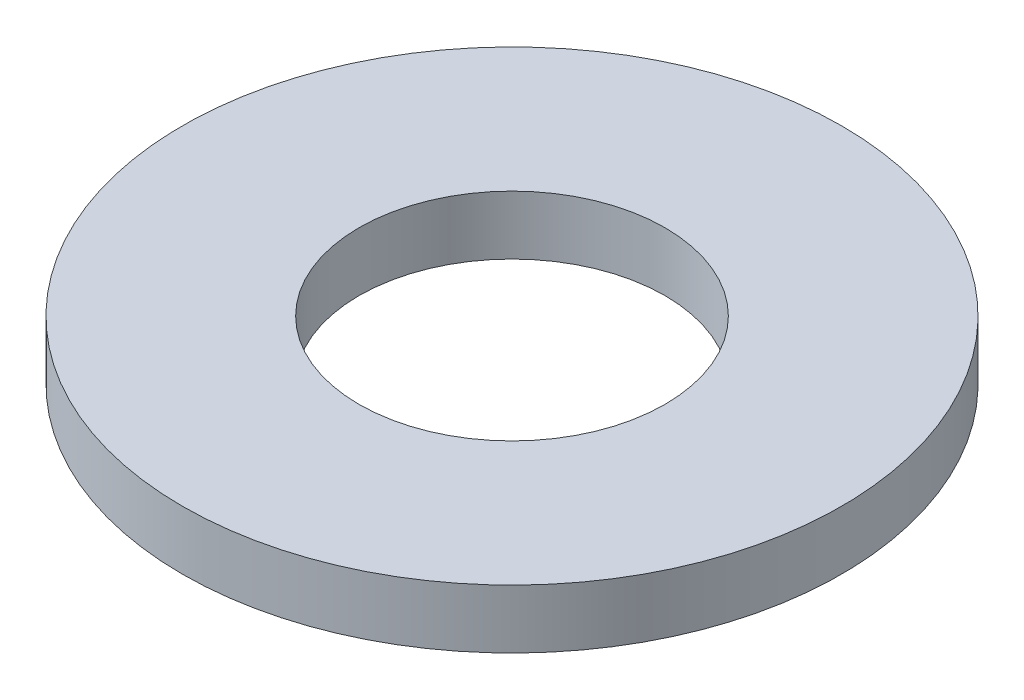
SolidWorks part; units mm, degrees
ref_plane "Plan1" through (0, 0, 0) normal (0, 0, 1) x (1, 0, 0)
ref_plane "Plan2" through (0, 0, 0) normal (0, 1, 0) x (1, 0, 0)
ref_plane "Plan3" through (0, 0, 0) normal (1, 0, 0) x (0, 0, -1)
sketch "Esquisse1" plane through (0, 0, 0) normal (0, 0, 1) x (1, 0, 0)
  line L0 (0, 0) -> (0, 50) construction
  line L1 (3.25, 0) -> (7, 0)
  line L2 (3.25, 0) -> (3.25, 1.25)
  line L3 (3.25, 1.25) -> (7, 1.25)
  line L4 (7, 0) -> (7, 1.25)
  dimension "D1" = 6.5
  dimension "D2" = 14
  dimension "D3" = 1.25
revolve "Base-Révolution" add sketch "Esquisse1" angle 360 about L0
